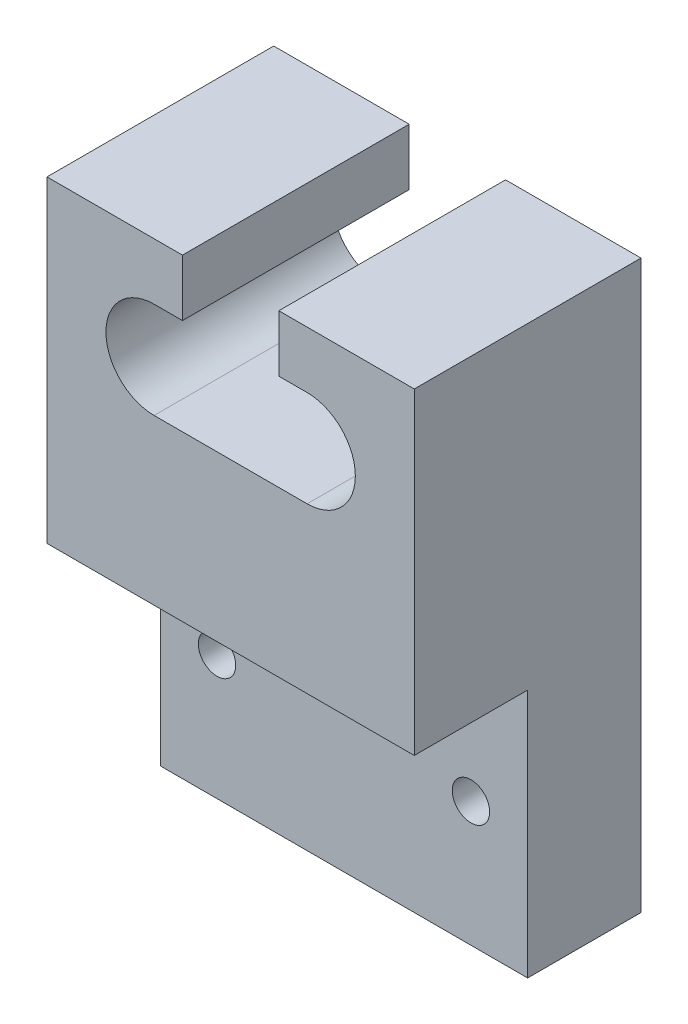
SolidWorks part; units mm, degrees
ref_plane "前视基准面" through (0, 0, 0) normal (0, 0, 1) x (1, 0, 0)
ref_plane "上视基准面" through (0, 0, 0) normal (0, 1, 0) x (1, 0, 0)
ref_plane "右视基准面" through (0, 0, 0) normal (1, 0, 0) x (0, 0, -1)
sketch "草图4" plane through (0, 0, 0) normal (0, 0, 1) x (1, 0, 0)
  line L0 (0, 0) -> (0, 50)
  line L1 (32.4, 0) -> (32.4, 50)
  line L2 (0, 0) -> (32.4, 0)
  line L3 (0, 50) -> (11.95, 50)
  line L4 (9.45, 45) -> (11.95, 45)
  line L5 (9.45, 36.5) -> (22.95, 36.5)
  line L6 (11.95, 45) -> (11.95, 50)
  line L7 (20.45, 45) -> (20.45, 50)
  line L8 (20.45, 45) -> (22.95, 45)
  line L9 (20.45, 50) -> (32.4, 50)
  arc A0 (9.45, 45) -> (9.45, 36.5) centre (9.45, 40.75) ccw
  arc A1 (22.95, 36.5) -> (22.95, 45) centre (22.95, 40.75) ccw
extrude "凸台-拉伸2" add sketch "草图4" along normal blind 20
sketch "草图5" plane through (32.4, 0, 0) normal (1, 0, 0) x (0, 0, -1)
  line L0 (-10, 0) -> (-10, 22)
  line L1 (-20, 22) -> (-10, 22)
extrude "切除-拉伸1" cut sketch "草图5" against normal through all and the other way through all flip side to cut
sketch "草图6" plane through (0, 0, 10) normal (0, 0, 1) x (1, 0, 0)
  circle A0 centre (5, 11) radius 1.65
  circle A1 centre (27.4, 11) radius 1.65
extrude "切除-拉伸2" cut sketch "草图6" against normal blind 20
